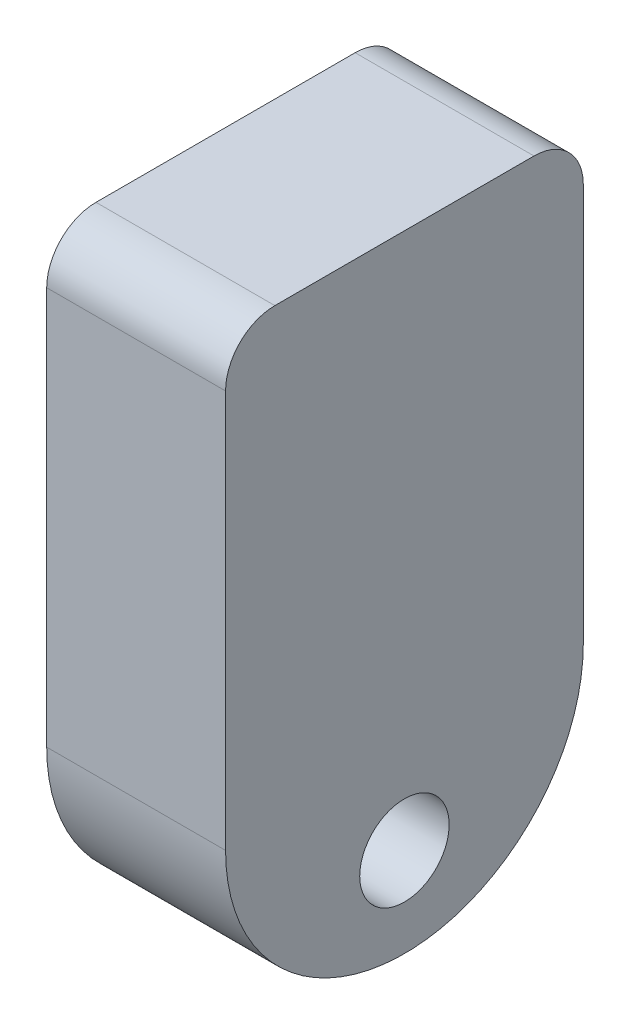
SolidWorks part; units mm, degrees
ref_plane "Front Plane" through (0, 0, 0) normal (0, 0, 1) x (1, 0, 0)
ref_plane "Top Plane" through (0, 0, 0) normal (0, 1, 0) x (1, 0, 0)
ref_plane "Right Plane" through (0, 0, 0) normal (1, 0, 0) x (0, 0, -1)
sketch "Sketch1" plane through (0, 0, 0) normal (1, 0, 0) x (0, 0, -1)
  line L0 (25.4, 88.9) -> (25.4, 63.5) construction
  line L1 (0, 0) -> (50.8, 0)
  line L2 (0, 0) -> (0, 88.9)
  line L3 (0, 88.9) -> (50.8, 88.9)
  line L4 (50.8, 0) -> (50.8, 88.9)
  circle A0 centre (25.4, 63.5) radius 6.35
  dimension "D4" = 12.7
  dimension "D1" = 50.8
  dimension "D2" = 88.9
  dimension "D3" = 25.4
extrude "Boss-Extrude1" add sketch "Sketch1" along normal blind 25.4
sketch "Sketch2" plane through (25.4, 0, 0) normal (1, 0, 0) x (0, 0, -1)
  circle A0 centre (25.4, 63.5) radius 6.35
extrude "Boss-Extrude2" add sketch "Sketch2" against normal blind 1
sketch "Sketch3" plane through (25.4, 0, 0) normal (1, 0, 0) x (0, 0, -1)
  line L0 (0, 0) -> (0, 25.4) construction
  line L1 (0, 88.9) -> (0, 0) construction
  line L2 (0, 25.4) -> (50.8, 25.4) construction
  line L3 (50.8, 0) -> (50.8, 88.9) construction
  line L4 (0, 25.4) -> (50.8, 25.4)
  arc A0 (0, 25.4) -> (50.8, 25.4) centre (25.4, 25.4) ccw
  dimension "D1" = 25.4
extrude "Cut-Extrude1" cut sketch "Sketch3" against normal through all both and the other way through all contours A0 M3 M4 | A0 M2 M3
sketch "Sketch4" plane through (25.4, 0, 0) normal (1, 0, 0) x (0, 0, -1)
  line L0 (0, 25.4) -> (50.8, 25.4)
  line L1 (25.4, 25.4) -> (25.4, 0)
  arc A0 (0, 25.4) -> (50.8, 25.4) centre (25.4, 25.4) ccw construction
  circle A1 centre (25.4, 12.7) radius 6.35
  dimension "D1" = 12.7
extrude "Cut-Extrude2" cut sketch "Sketch4" against normal blind 24.4 and the other way through all contours L1 A1 | L1 A1
fillet "Fillet1" radius 7 2 edges at (12.7, 88.9, -50.8) (12.7, 88.9, 0)
